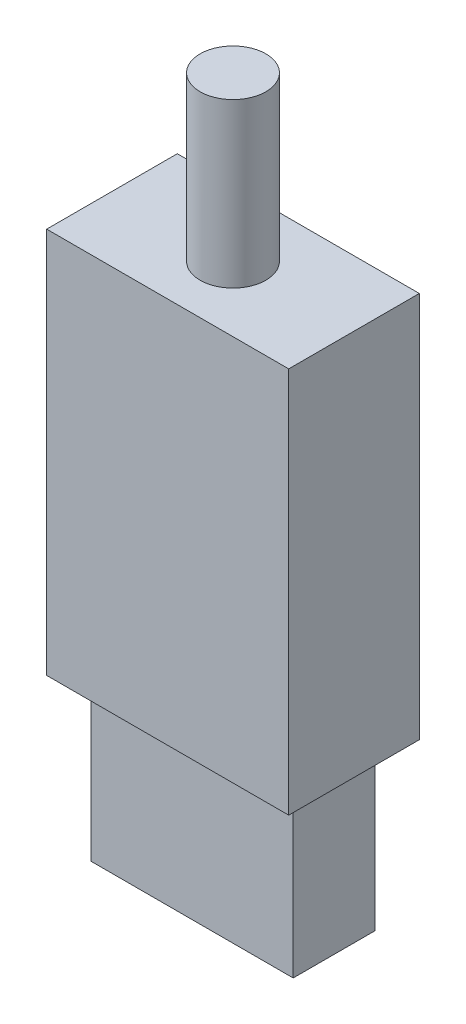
SolidWorks part; units mm, degrees
ref_plane "Front Plane" through (0, 0, 0) normal (0, 0, 1) x (1, 0, 0)
ref_plane "Top Plane" through (0, 0, 0) normal (0, 1, 0) x (1, 0, 0)
ref_plane "Right Plane" through (0, 0, 0) normal (1, 0, 0) x (0, 0, -1)
sketch "Sketch1" plane through (0, 0, 0) normal (0, 1, 0) x (1, 0, 0)
  line L0 (0, 0) -> (12.573, 0) construction
  line L1 (0, 0) -> (12.573, 0)
  line L2 (0, 0) -> (0, 5.08)
  line L3 (0, 5.08) -> (12.573, 5.08)
  line L4 (12.573, 0) -> (12.573, 5.08)
  line L5 (12.573, 0) -> (12.573, 5.08) construction
extrude "Boss-Extrude1" add sketch "Sketch1" along normal blind 10.16
sketch "Sketch2" plane through (0, 10.16, 0) normal (0, 1, 0) x (1, 0, 0)
  line L0 (0, 0) -> (0, -1.524) construction
  line L1 (-1.2446, -1.524) -> (13.8176, -1.524)
  line L2 (-1.2446, -1.524) -> (-1.2446, 6.604)
  line L3 (-1.2446, 6.604) -> (13.8176, 6.604)
  line L4 (13.8176, -1.524) -> (13.8176, 6.604)
  line L5 (0, 0) -> (-1.2446, 0) construction
  line L6 (12.573, 5.08) -> (12.573, 6.604) construction
  line L7 (12.573, 5.08) -> (13.8176, 5.08) construction
  dimension "D1" = 8.128
  dimension "D2" = 15.0622
extrude "Boss-Extrude2" add sketch "Sketch2" along normal blind 24.0538
sketch "Sketch3" plane through (0, 34.2138, 0) normal (0, 1, 0) x (1, 0, 0)
  line L0 (13.8176, 6.604) -> (-1.2446, 6.604) construction
  line L1 (-1.2446, 6.604) -> (-1.2446, -1.524) construction
  circle A0 centre (6.2865, 2.54) radius 2.0447
  point P5 (6.2865, 6.604)
  point P9 (-1.2446, 2.54)
  dimension "D1" = 4.0894
extrude "Boss-Extrude3" add sketch "Sketch3" along normal blind 10.16
